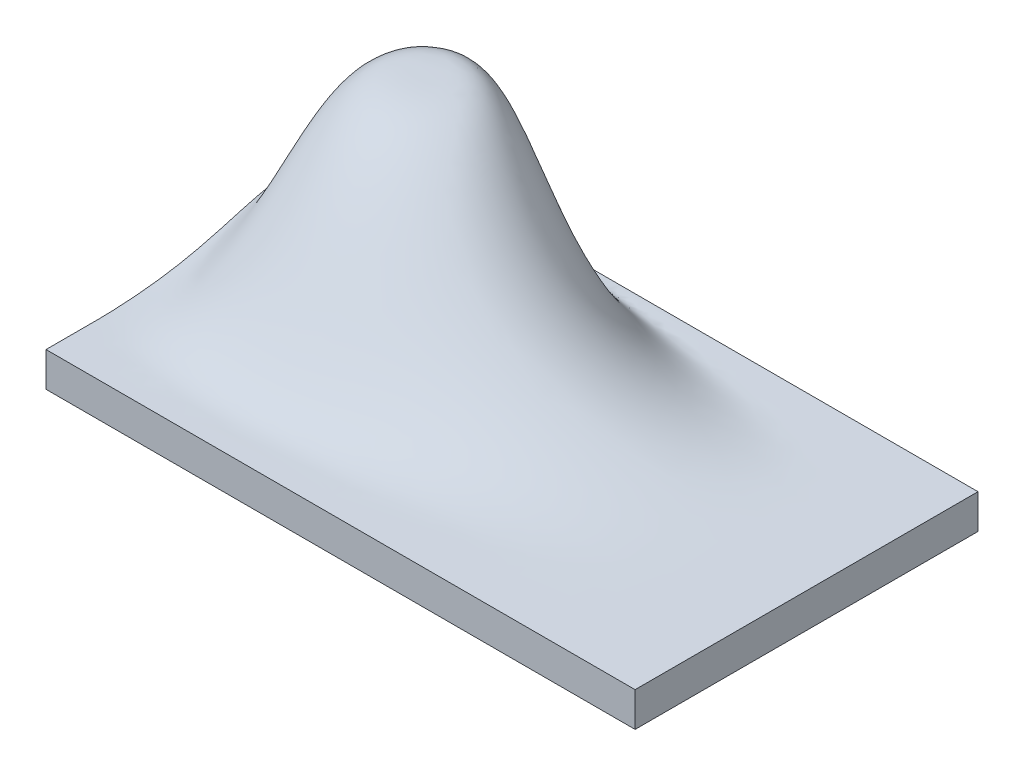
SolidWorks part; units mm, degrees
ref_plane "Front" through (0, 0, 0) normal (0, 0, 1) x (1, 0, 0)
ref_plane "Top" through (0, 0, 0) normal (0, 1, 0) x (1, 0, 0)
ref_plane "Right" through (0, 0, 0) normal (1, 0, 0) x (0, 0, -1)
sketch "Sketch1" plane through (0, 0, 0) normal (0, 1, 0) x (1, 0, 0)
  line L1 (-83.5956, 51.8031) -> (87.3359, 51.8031)
  line L2 (-83.5956, 51.8031) -> (-83.5956, -47.6888)
  line L3 (-83.5956, -47.6888) -> (87.3359, -47.6888)
  line L4 (87.3359, 51.8031) -> (87.3359, -47.6888)
extrude "Extrude1" add sketch "Sketch1" along normal blind 10
other "Deform2" parameters "D1"=50, "D2"=100
